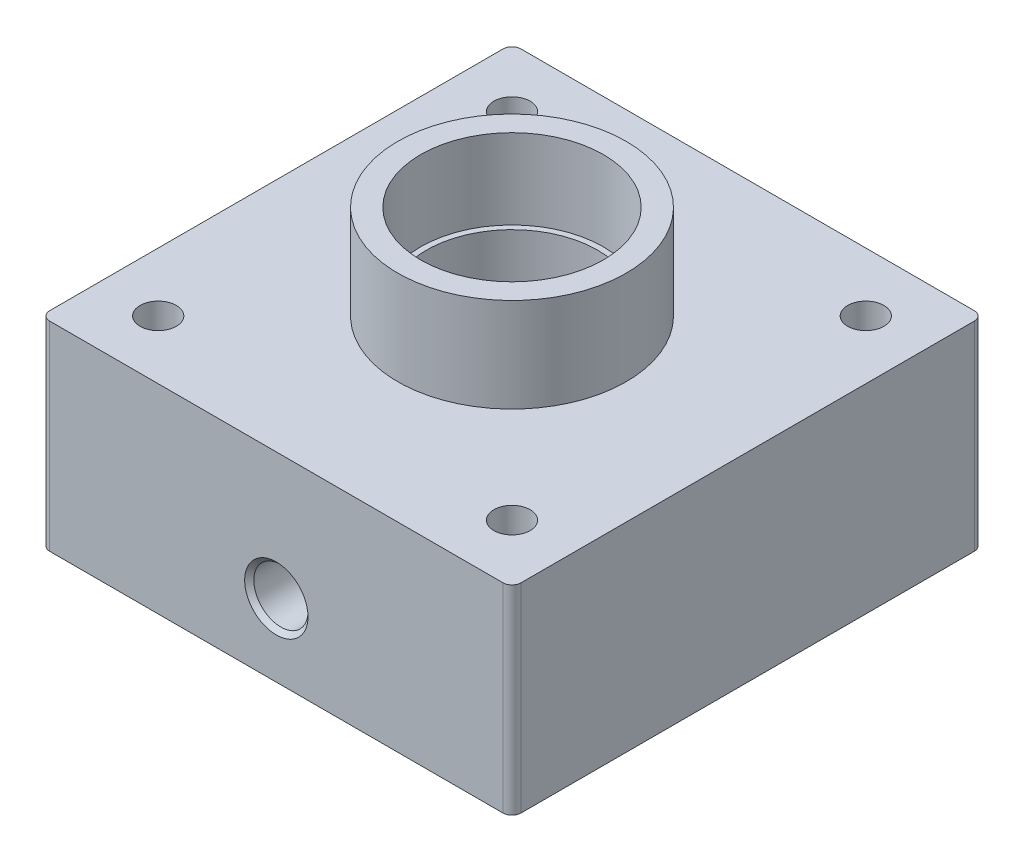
SolidWorks part; units mm, degrees
ref_plane "Front Plane" through (0, 0, 0) normal (0, 0, 1) x (1, 0, 0)
ref_plane "Top Plane" through (0, 0, 0) normal (0, 1, 0) x (1, 0, 0)
ref_plane "Right Plane" through (0, 0, 0) normal (1, 0, 0) x (0, 0, -1)
sketch "Sketch1" plane through (0, 0, 0) normal (0, 1, 0) x (1, 0, 0)
  line L1 (-82.55, 82.55) -> (82.55, 82.55)
  line L2 (-82.55, 82.55) -> (-82.55, -82.55)
  line L3 (-82.55, -82.55) -> (82.55, -82.55)
  line L4 (82.55, 82.55) -> (82.55, -82.55)
  line L5 (-82.55, 82.55) -> (82.55, -82.55) construction
  line L6 (-82.55, -82.55) -> (82.55, 82.55) construction
  point P0 (0, 0)
  dimension "D1" = 165.1
extrude "Boss-Extrude1" add sketch "Sketch1" along normal blind 50.8
sketch "Sketch2" plane through (0, 50.8, 0) normal (0, 1, 0) x (1, 0, 0)
  circle A0 centre (0, 0) radius 40
  dimension "D1" = 80
extrude "Boss-Extrude2" add sketch "Sketch2" along normal blind 52
sketch "Sketch3" plane through (0, 102.8, 0) normal (0, 1, 0) x (1, 0, 0)
  circle A0 centre (0, 0) radius 32
  dimension "D1" = 64
extrude "Cut-Extrude1" cut sketch "Sketch3" against normal blind 28
sketch "Sketch4" plane through (0, 74.8, 0) normal (0, 1, 0) x (1, 0, 0)
  circle A0 centre (0, 0) radius 30
  dimension "D1" = 60
extrude "Cut-Extrude2" cut sketch "Sketch4" against normal blind 22
fillet "Fillet1" radius 3.175 4 edges at (82.55, 25.4, -82.55) (-82.55, 25.4, -82.55) (82.55, 25.4, 82.55) (-82.55, 25.4, 82.55)
sketch "Sketch5" plane through (0, 0, 0) normal (0, -1, 0) x (1, 0, 0)
  circle A0 centre (0, 0) radius 20
  dimension "D1" = 40
extrude "Cut-Extrude3" cut sketch "Sketch5" against normal blind 40
sketch "Sketch6" plane through (0, 0, 0) normal (0, -1, 0) x (1, 0, 0)
  circle A0 centre (0, 0) radius 76.2
  circle A1 centre (0, 0) radius 69.85
  dimension "D1" = 152.4
  dimension "D2" = 139.7
extrude "Cut-Extrude4" cut sketch "Sketch6" against normal blind 8
sketch "Sketch7" plane through (0, 0, 82.55) normal (0, 0, 1) x (1, 0, 0)
  line L0 (-79.375, 25.4) -> (79.375, 25.4) construction
  line L1 (-79.375, 50.8) -> (-79.375, 0) construction
  line L2 (79.375, 0) -> (79.375, 50.8) construction
  point P6 (0, 25.4)
hole_wizard "1/2-14 NPSM Tapped Hole1" positions "3DSketch2" profile "Sketch9" tap size "1/2-14 NPSM" standard "ANSI Inch"
sketch3d "3DSketch2"
  point P0 (0, 25.4, 82.55)
sketch "Sketch9" plane through (0, 25.4, 82.55) normal (1, 0, 0) x (0, -1, 0)
  line L0 (0, 0) -> (0, 52.9403)
  line L1 (0, 52.9403) -> (9.4869, 47.24)
  line L2 (9.4869, 47.24) -> (9.4869, 1.6002)
  line L3 (9.4869, 1.6002) -> (11.0871, 0)
  line L5 (11.0871, 0) -> (0, 0)
  line L6 (-9.4869, 1.6002) -> (-11.0871, 0) construction
  line L10 (0, 52.9403) -> (-9.4869, 47.24) construction
  line L11 (0, -6.35) -> (0, 107.95) construction
  dimension "Tap Drill Dia." = 18.9738
  dimension "Tap Drill Depth" = 47.24
  dimension "Near C'Sink Dia." = 22.1742
  dimension "Near C'Sink Angle" = 90
  dimension "Drill Angle" = 118
sketch "Sketch10" plane through (0, 0, 0) normal (0, -1, 0) x (1, 0, 0)
  line L0 (-79.375, 82.55) -> (79.375, 82.55) construction
  circle A0 centre (0, 50.55) radius 6.35
  point P4 (0, 0)
  dimension "D1" = 12.7
  dimension "D2" = 32
extrude "Cut-Extrude5" cut sketch "Sketch10" against normal blind 25
sketch "Sketch11" plane through (0, 0, 0) normal (0, -1, 0) x (1, 0, 0)
  line L1 (-61.9638, 61.9638) -> (61.9638, 61.9638) construction
  line L2 (-61.9638, 61.9638) -> (-61.9638, -61.9638) construction
  line L3 (-61.9638, -61.9638) -> (61.9638, -61.9638) construction
  line L4 (61.9638, 61.9638) -> (61.9638, -61.9638) construction
  line L5 (-61.9638, 61.9638) -> (61.9638, -61.9638) construction
  line L6 (-61.9638, -61.9638) -> (61.9638, 61.9638) construction
  circle A0 centre (0, 0) radius 87.63 construction
  circle A1 centre (-61.9638, 61.9638) radius 6.35
  circle A2 centre (61.9638, 61.9638) radius 6.35
  circle A3 centre (61.9638, -61.9638) radius 6.35
  circle A4 centre (-61.9638, -61.9638) radius 6.35
  dimension "D1" = 175.26
  dimension "D2" = 12.7
extrude "Cut-Extrude6" cut sketch "Sketch11" against normal through all
sketch "Sketch12" plane through (0, 50.8, 0) normal (0, 1, 0) x (1, 0, 0)
  line L0 (-82.55, 79.375) -> (-82.55, -79.375) construction
  line L1 (79.375, 82.55) -> (-79.375, 82.55) construction
  line L2 (82.55, -79.375) -> (82.55, 79.375) construction
  line L3 (-79.375, -82.55) -> (79.375, -82.55) construction
  line L4 (-82.55, 79.375) -> (-82.55, -79.375)
  line L5 (79.375, 82.55) -> (-79.375, 82.55)
  line L6 (82.55, -79.375) -> (82.55, 79.375)
  line L7 (-79.375, -82.55) -> (79.375, -82.55)
  circle A4 centre (-61.9638, 61.9638) radius 6.35 construction
  circle A5 centre (61.9638, 61.9638) radius 6.35 construction
  circle A6 centre (61.9638, -61.9638) radius 6.35 construction
  circle A7 centre (-61.9638, -61.9638) radius 6.35 construction
  circle A8 centre (-61.9638, 61.9638) radius 6.35
  circle A9 centre (61.9638, 61.9638) radius 6.35
  circle A10 centre (61.9638, -61.9638) radius 6.35
  circle A11 centre (-61.9638, -61.9638) radius 6.35
extrude "Boss-Extrude4" add sketch "Sketch12" along normal blind 19.05 contours M13 M6 M7 M8 M9 M10 M11 M12 M2 M4 M5 M3 M1
